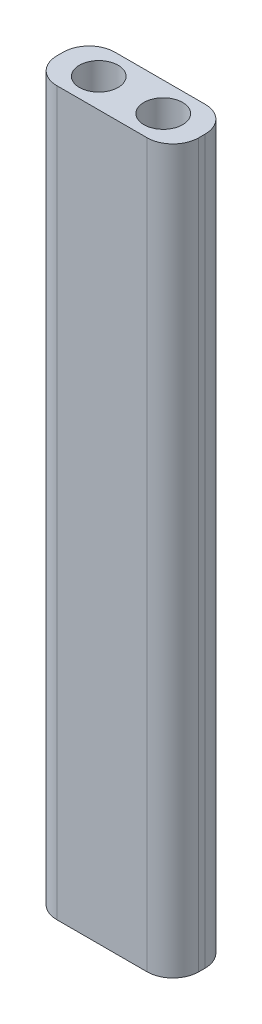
SolidWorks part; units mm, degrees
ref_plane "Front Plane" through (0, 0, 0) normal (0, 0, 1) x (1, 0, 0)
ref_plane "Top Plane" through (0, 0, 0) normal (0, 1, 0) x (1, 0, 0)
ref_plane "Right Plane" through (0, 0, 0) normal (1, 0, 0) x (0, 0, -1)
sketch "Sketch1" plane through (0, 0, 0) normal (0, 1, 0) x (1, 0, 0)
  line L0 (0, 2.06) -> (0, -1.9505)
  line L2 (-5.5, -2.25) -> (5.5, -2.25)
  line L3 (-5.5, -2.25) -> (-5.5, 2.25)
  line L4 (-5.5, 2.25) -> (5.5, 2.25)
  line L5 (5.5, -2.25) -> (5.5, 2.25)
  line L6 (-5.5, -2.25) -> (5.5, 2.25) construction
  line L7 (-5.5, 2.25) -> (5.5, -2.25) construction
  circle A0 centre (-2.5, 0) radius 1.5
  circle A2 centre (2.5, 0) radius 1.5
  point P7 (0, 0)
  dimension "D1" = 3
  dimension "D4" = 2.25
  dimension "D2" = 11
  dimension "D3" = 4.5
  dimension "D5" = 5
extrude "Boss-Extrude1" add sketch "Sketch1" along normal blind 56
fillet "Fillet1" radius 2 4 edges at (-5.5, 28, 2.25) (-5.5, 28, -2.25) (5.5, 28, -2.25) (5.5, 28, 2.25)
